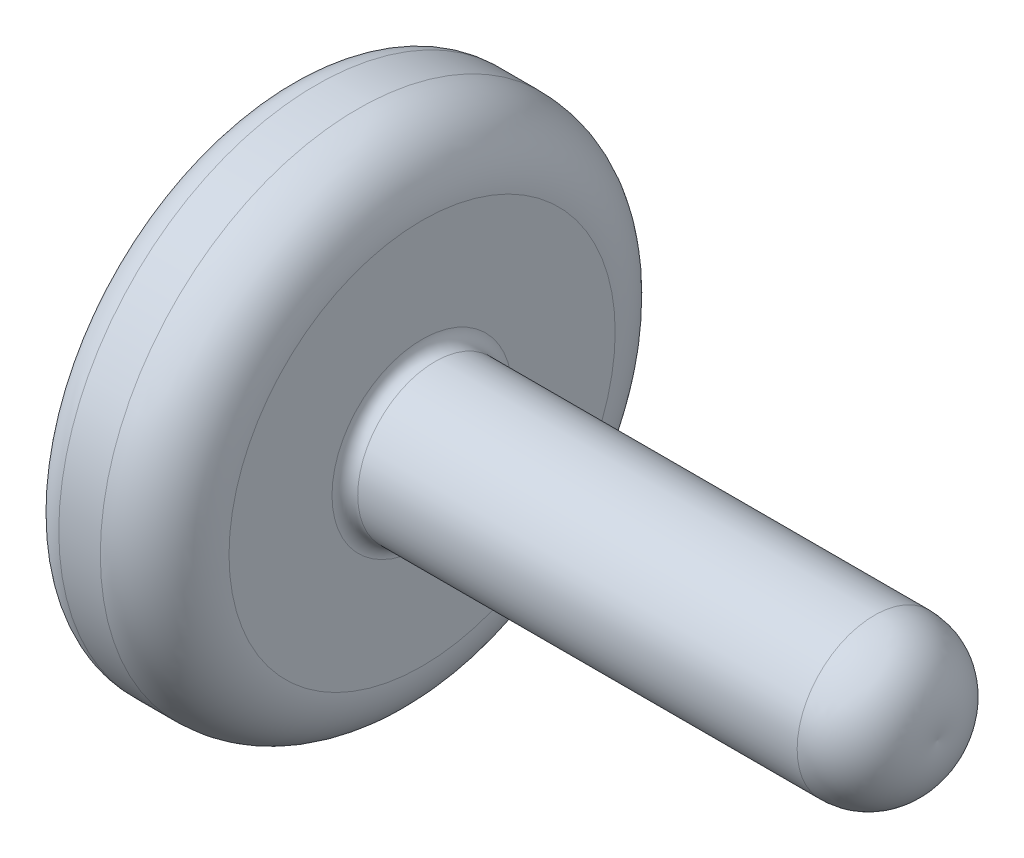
SolidWorks part; units mm, degrees
ref_plane "Plane1" through (0, 0, 0) normal (0, 0, 1) x (1, 0, 0)
ref_plane "Plane2" through (0, 0, 0) normal (0, 1, 0) x (1, 0, 0)
ref_plane "Plane3" through (0, 0, 0) normal (1, 0, 0) x (0, 0, -1)
revolve "Base-Revolve" add sketch "BodySke"
sketch "BodySke" plane through (0, 0, 0) normal (0, 0, 1) x (1, 0, 0)
  line L0 (1.5, 0.6) -> (1.5, 1.5)
  line L1 (1.725, 6.35) -> (1.725, -3.175) construction
  line L2 (-25.4, 0) -> (127, 0) construction
  line L3 (5.5, 0) -> (0, 0)
  line L4 (1.5, 0.6) -> (5.0137, 0.6)
  line L6 (0.6774, 2) -> (1, 2)
  line L8 (2.1, 6.35) -> (2.1, -3.175) construction
  arc A0 (0.4653, 1.8723) -> (0, 0) centre (4, 0) ccw
  arc A1 (5.5, 0) -> (5.0137, 0.6) centre (5.0137, 0.1029) ccw
  arc A2 (0.4653, 1.8723) -> (0.6774, 2) centre (0.6774, 1.76) cw
  arc A3 (1.5, 1.5) -> (1, 2) centre (1, 1.5) ccw
  point P19 (1.5, 2)
  dimension "Head_fillet_rad" = 0.24
  dimension "D3" = 0.5
  dimension "Head_crown_rad" = 4
  dimension "D1" = 0.6
  dimension "D2" = 4
  dimension "Head_ht" = 1.5
  dimension "Head_dia" = 4
  dimension "Advance" = 0.45
fillet "Fillet1" radius 0.1 1 edges at (1.5, 0, 0.6)
sketch "Sketch3" plane through (0, 0, 0) normal (1, 0, 0) x (0, 0, -1)
  line L0 (0.37, -1.3) -> (-0.37, -1.3)
  line L1 (0.37, -1.3) -> (0.37, 1.3)
  line L2 (-0.37, 1.3) -> (0.37, 1.3)
  line L3 (-0.37, 1.3) -> (-0.37, -1.3)
  dimension "D1" = 1.3
  dimension "Cross_dia" = 2.6
  dimension "D2" = 0.37
  dimension "Cross_width" = 0.74
ref_plane "Plane4" through (1.5, 0, 0) normal (1, 0, 0) x (0, 0, -1)
sketch "Sketch4" plane through (1.5, 0, 0) normal (1, 0, 0) x (0, 0, -1)
  line L0 (0.37, -0.5521) -> (-0.37, -0.5521)
  line L1 (0.37, -0.5521) -> (0.37, 0.5521)
  line L2 (-0.37, 0.5521) -> (0.37, 0.5521)
  line L3 (-0.37, 0.5521) -> (-0.37, -0.5521)
  dimension "D1" = 0.74
  dimension "D2" = 1.1043
  dimension "D3" = 0.37
  dimension "D4" = 0.5521
loft "Recess" cut profiles "Sketch3", "Sketch4"
pattern_circular "RecPat" count 2 every 90 about axis through (0, 0, 0) along (1, 0, 0) of "Recess"
sketch "RecCorSke" plane through (0, 0, 0) normal (0, 0, 1) x (1, 0, 0)
  line L0 (-3.175, 0) -> (15.875, 0) construction
  line L1 (-25.4, 0) -> (127, 0) construction
  line L2 (0, 0) -> (0, 0.6609)
  line L3 (0, 0.6609) -> (1.5, 0.556)
  line L4 (1.5, 0.556) -> (1.6807, 0)
  line L5 (1.6807, 0) -> (0, 0)
  dimension "Diameter" = 1.112
  dimension "Depth" = 1.5
  dimension "Draft_angle" = 4
  dimension "Bottom_angle" = 18
revolve "RecessCore" cut sketch "RecCorSke" angle 360 about L0
sketch "ThdSchSke" plane through (0, 0, 0) normal (0, 0, 1) x (1, 0, 0)
  line L0 (3, -0.9965) -> (2.8225, -1.25)
  line L1 (3, -0.9965) -> (3.1775, -1.25)
  line L2 (3.1775, -1.25) -> (3.1775, -1.5625)
  line L3 (-3.175, 0) -> (5.1513, 0) construction
  line L5 (3.1775, -1.5625) -> (2.8225, -1.5625)
  line L6 (2.8225, -1.5625) -> (2.8225, -1.25)
  dimension "Thread_minor" = 1.993
  dimension "Diameter" = 2.5
  dimension "Start" = 3
  dimension "SideAngle" = 55
  dimension "VeeAngle" = 70
  dimension "Overcut" = 3.125
revolve "ThreadSchematic" cut sketch "ThdSchSke" angle 360 about L3
pattern_linear "ThdSchPat"
